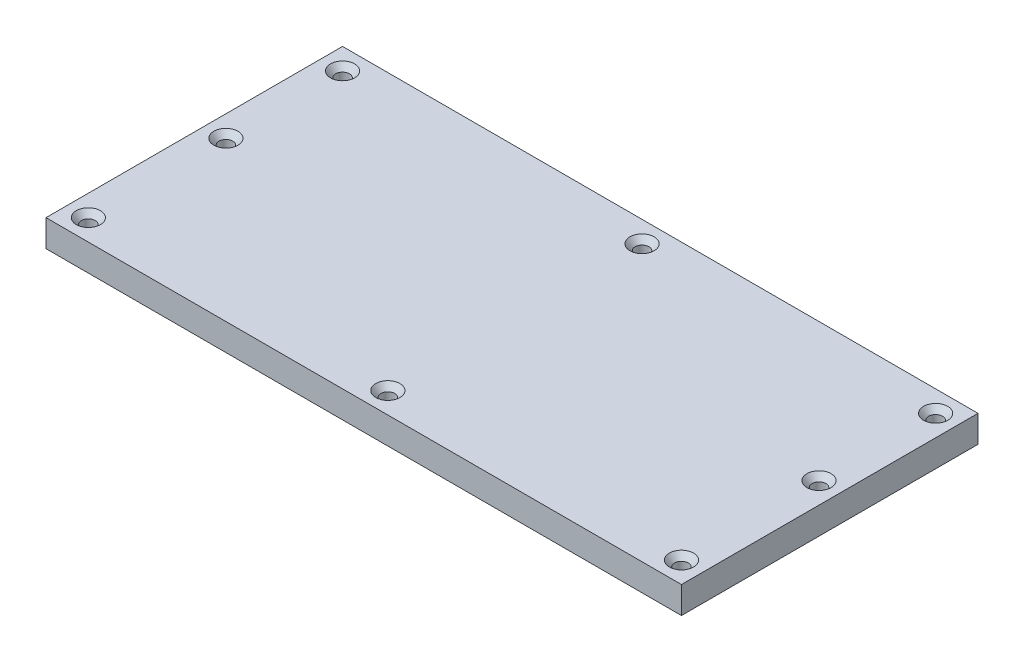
SolidWorks part; units mm, degrees
ref_plane "Front Plane" through (0, 0, 0) normal (0, 0, 1) x (1, 0, 0)
ref_plane "Top Plane" through (0, 0, 0) normal (0, 1, 0) x (1, 0, 0)
ref_plane "Right Plane" through (0, 0, 0) normal (1, 0, 0) x (0, 0, -1)
sketch "Sketch2" plane through (0, 0, 0) normal (0, 1, 0) x (1, 0, 0)
  line L1 (75, -35) -> (-75, -35)
  line L2 (75, -35) -> (75, 35)
  line L3 (75, 35) -> (-75, 35)
  line L4 (-75, -35) -> (-75, 35)
  line L5 (75, -35) -> (-75, 35) construction
  line L6 (75, 35) -> (-75, -35) construction
  point P0 (0, 0)
  dimension "D1" = 70
  dimension "D2" = 150
extrude "Boss-Extrude1" add sketch "Sketch2" along normal blind 6.35
sketch "Sketch4" plane through (0, 6.35, 0) normal (0, 1, 0) x (1, 0, 0)
  line L0 (-75, 35) -> (-75, -35) construction
  line L1 (75, 35) -> (-75, 35) construction
  line L2 (75, -35) -> (75, 35) construction
  line L3 (-75, -35) -> (75, -35) construction
  point P0 (-70, 30)
  point P1 (-70, 30)
  point P2 (0.6943, 30)
  point P3 (70, 30)
  point P4 (70, 2.4696)
  point P5 (70, -30)
  point P6 (0.6943, -30)
  point P7 (-70, -30)
  point P8 (-70, 2.4696)
  point P9 (0, 0)
hole_wizard "CSK for #4 Flat Head Machine Screw1" positions "3DSketch1" profile "Sketch5" countersink size "#4" standard "ANSI Inch"
sketch3d "3DSketch1"
  point P0 (-70, 6.35, -30)
  point P4 (0.6943, 6.35, -30)
  point P7 (70, 6.35, -30)
  point P10 (70, 6.35, -2.4696)
  point P13 (70, 6.35, 30)
  point P16 (0.6943, 6.35, 30)
  point P19 (-70, 6.35, 30)
  point P22 (-70, 6.35, -2.4696)
sketch "Sketch5" plane through (-70, 6.35, -30) normal (1, 0, 0) x (0, 0, 1)
  line L0 (0, 0) -> (0, 6.35)
  line L1 (0, 6.35) -> (1.6319, 6.35)
  line L2 (1.6319, 6.35) -> (1.6319, 1.4098)
  line L3 (1.6319, 1.4098) -> (2.8575, 0)
  line L5 (2.8575, 0) -> (0, 0)
  line L6 (-1.6319, 1.4098) -> (-2.8575, 0) construction
  line L11 (0, -6.35) -> (0, 107.95) construction
  dimension "Thru Hole Dia." = 3.2639
  dimension "Thru Hole Depth" = 6.35
  dimension "Near C'Sink Dia." = 5.715
  dimension "Near C'Sink Angle" = 82
equation "\"D2@Sketch4\"=\"D1@Sketch4\""
equation "\"D3@Sketch4\"=\"D1@Sketch4\""
equation "\"D4@Sketch4\"=\"D1@Sketch4\""
